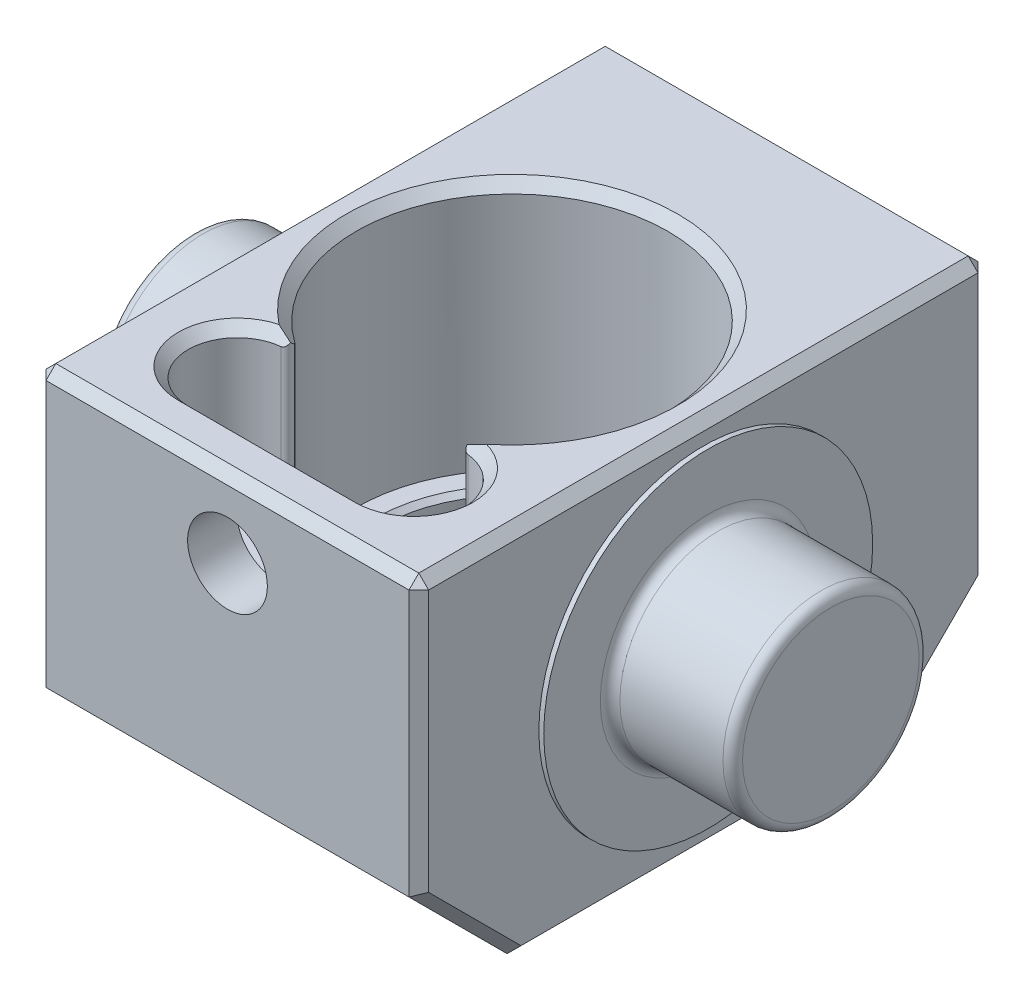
SolidWorks part; units mm, degrees
ref_plane "Front Plane" through (0, 0, 0) normal (0, 0, 1) x (1, 0, 0)
ref_plane "Top Plane" through (0, 0, 0) normal (0, 1, 0) x (1, 0, 0)
ref_plane "Right Plane" through (0, 0, 0) normal (1, 0, 0) x (0, 0, -1)
sketch "Sketch1" plane through (0, 0, 0) normal (1, 0, 0) x (0, 0, -1)
  line L1 (-14.5, 9.525) -> (14.5, 9.525)
  line L2 (-14.5, 9.525) -> (-14.5, -9.525)
  line L3 (-14.5, -9.525) -> (14.5, -9.525)
  line L4 (14.5, 9.525) -> (14.5, -9.525)
  line L5 (-14.5, 9.525) -> (14.5, -9.525) construction
  line L6 (-14.5, -9.525) -> (14.5, 9.525) construction
  point P0 (0, 0)
  dimension "D1" = 19.05
  dimension "D2" = 29
extrude "Boss-Extrude1" add sketch "Sketch1" along normal mid plane 19.5
sketch "Sketch2" plane through (0, 0, 0) normal (0, 0, 1) x (1, 0, 0)
  line L0 (0, 0) -> (15.0375, 0) construction
  line L1 (9.75, 8.382) -> (10, 8.382)
  line L2 (9.75, 9.525) -> (9.75, -9.525) construction
  line L3 (10, 8.382) -> (10, 5)
  line L4 (10, 5) -> (16.25, 5)
  line L5 (16.25, 5) -> (16.25, 0)
  line L6 (16.25, 0) -> (9.75, 0)
  line L7 (9.75, 0) -> (9.75, 8.382)
  line L8 (0, 10.193) -> (0, -1.9896) construction
  dimension "D1" = 16.764
  dimension "D2" = 20
  dimension "D3" = 10
  dimension "D4" = 32.5
revolve "Revolve1" add sketch "Sketch2" angle 360 about L0
mirror "Mirror1" about plane through (0, 0, 0) normal (1, 0, 0) of "Revolve1"
sketch "Sketch3" plane through (0, 0, 0) normal (0, 0, 1) x (1, 0, 0)
  line L0 (0, 9.525) -> (0, -3.175)
  line L1 (9.75, 9.525) -> (-9.75, 9.525) construction
  line L2 (0, -3.175) -> (-7.9413, -3.175)
  line L3 (-7.9413, -3.175) -> (-7.9413, 9.525)
  line L4 (-7.9413, 9.525) -> (0, 9.525)
  line L5 (0, 10.1247) -> (0, -4.0859) construction
  dimension "D1" = 15.8826
  dimension "D2" = 3.175
revolve "Cut-Revolve1" cut sketch "Sketch3" angle 360 about L5
sketch "Sketch4" plane through (0, 0, 0) normal (0, 0, 1) x (1, 0, 0)
  line L0 (0, -9.525) -> (0, -3.175)
  line L1 (9.75, -9.525) -> (-9.75, -9.525) construction
  line L2 (0, -9.525) -> (-6.731, -9.525)
  line L3 (-6.731, -9.525) -> (-6.731, -3.175)
  line L4 (7.9413, -3.175) -> (-7.9413, -3.175) construction
  line L5 (-6.731, -3.175) -> (0, -3.175)
  line L6 (0, -1.9252) -> (0, -10.0139) construction
  dimension "D1" = 13.462
revolve "Cut-Revolve2" cut sketch "Sketch4" angle 360 about L6
sketch "Sketch5" plane through (0, 9.525, 0) normal (0, 1, 0) x (1, 0, 0)
  line L0 (-4.5, -9.4958) -> (4.5, -9.4958) construction
  line L1 (-4.5, -6.9939) -> (4.5, -6.9939)
  line L2 (-4.5, -11.9977) -> (4.5, -11.9977)
  line L3 (-1.1729, 0) -> (1.6976, 0) construction
  arc A0 (-4.5, -6.9939) -> (-4.5, -11.9977) centre (-4.5, -9.4958) ccw
  arc A1 (4.5, -11.9977) -> (4.5, -6.9939) centre (4.5, -9.4958) ccw
  circle A4 centre (0, 0) radius 7.9413 construction
  point P2 (0, -9.4958)
  dimension "D1" = 14.9352
  dimension "D2" = 6.9939
  dimension "D3" = 5.0038
  dimension "D4" = 9
extrude "Cut-Extrude1" cut sketch "Sketch5" against normal blind 6.5
chamfer "Chamfer1" distance 5 angle 45 2 edges at (0, -9.525, -14.5) (0, -9.525, 14.5)
chamfer "Chamfer2" distance 0.5 angle 45 14 edges at (9.75, -7.025, 12) (9.75, 2.5, 14.5) (9.75, -9.525, 0) (9.75, -7.025, -12) (9.75, 2.5, -14.5) (-9.75, 2.5, 14.5) (-9.75, -7.025, 12) (-9.75, -9.525, 0) (-9.75, -7.025, -12) (-9.75, 2.5, -14.5) (0, 9.525, -14.5) (9.75, 9.525, 0) (0, 9.525, 14.5) (-9.75, 9.525, 0)
chamfer "Chamfer4" distance 0.508 angle 45 6 edges at (-4.1308, 9.525, 6.9939) (-7.0019, 9.525, 9.4958) (0, 9.525, 11.9977) (7.0019, 9.525, 9.4958) (4.1308, 9.525, 6.9939) (0, 9.525, -7.9413)
fillet "Fillet1" radius 0.3 2 edges at (3.7616, 6.021, 6.9939) (-3.7616, 6.021, 6.9939)
chamfer "Chamfer5" distance 0.254 angle 45 2 edges at (0, -3.175, 6.731) (0, -9.525, 6.731)
fillet "Fillet2" radius 0.5 2 edges at (-16.25, 0, 5) (16.25, 0, 5)
fillet "Fillet3" radius 0.5 2 edges at (10, 0, 5) (-10, 0, 5)
sketch "Sketch9" plane through (0, 0, 14.5) normal (0, 0, 1) x (1, 0, 0)
  line L0 (0, 3.025) -> (0, 9.525) construction
  line L1 (-4.5, 3.025) -> (4.5, 3.025) construction
  line L2 (-9.25, 9.525) -> (9.25, 9.525) construction
  circle A0 centre (0, 5.585) radius 2.032
  circle A1 centre (0, 5.585) radius 3.3274 construction
  dimension "D1" = 4.064
  dimension "D2" = 6.6548
  dimension "D3" = 3.94
extrude "Cut-Extrude2" cut sketch "Sketch9" against normal up to next
